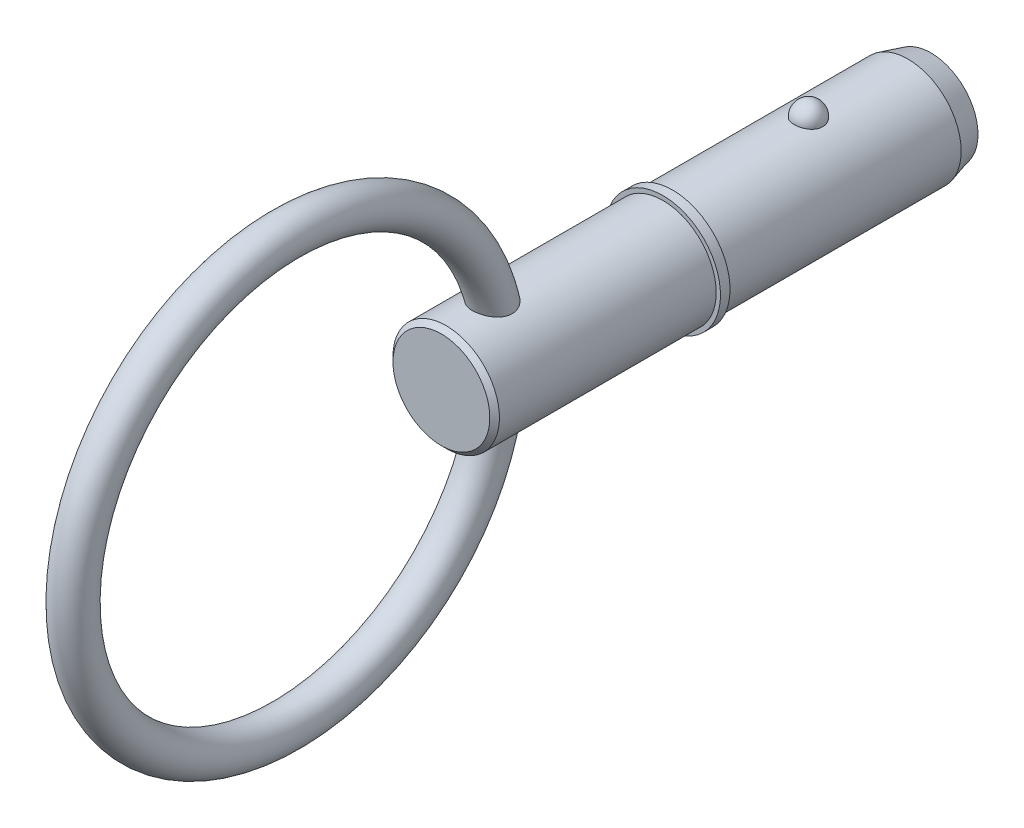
SolidWorks part; units mm, degrees
ref_plane "Front Plane" through (0, 0, 0) normal (0, 0, 1) x (1, 0, 0)
ref_plane "Top Plane" through (0, 0, 0) normal (0, 1, 0) x (1, 0, 0)
ref_plane "Right Plane" through (0, 0, 0) normal (1, 0, 0) x (0, 0, -1)
sketch "Sketch2" plane through (0, 0, 0) normal (0, 0, 1) x (1, 0, 0)
  circle A0 centre (0, 0) radius 5.555
  point P3 (0, 5.555)
  dimension "D1" = 11.11
extrude "Boss-Extrude1" add sketch "Sketch2" along normal blind 12.7
sketch "Sketch3" plane through (0, 0, 0) normal (0, 0, -1) x (-1, 0, 0)
  circle A0 centre (0, 0) radius 5.555
  dimension "D1" = 11.11
extrude "Boss-Extrude2" add sketch "Sketch3" along normal blind 14.27
chamfer "Chamfer1" distance 2.4 angle 15 1 edges at (-5.555, 0, -14.27)
sketch "Sketch18" plane through (0, 0, 0) normal (1, 0, 0) x (0, 0, -1)
  line L0 (11.87, 5.555) -> (-12.7, 5.555) construction
  line L1 (1.49, 7.045) -> (1.49, 4.065)
  line L2 (-12.7, -5.555) -> (11.87, -5.555) construction
  arc A0 (1.49, 7.045) -> (1.49, 4.065) centre (1.49, 5.555) ccw
  point P4 (0, 5.555)
  dimension "D1" = 12.6
revolve "Revolve1" add sketch "Sketch18" angle 360 about L1
sketch "Sketch19" plane through (0, 0, 0) normal (1, 0, 0) x (0, 0, -1)
  line L0 (-33.7288, 0) -> (-46.4542, 0) construction
sketch "Sketch20" plane through (0, 0, 0) normal (1, 0, 0) x (0, 0, -1)
  line L0 (-12.7, 0) -> (-12.7, 6)
  line L1 (-12.7, 5.555) -> (-12.7, -5.555) construction
  line L2 (-12.7, 6) -> (-13.7, 6)
  line L3 (-13.7, 6) -> (-13.7, 0)
  line L4 (-33.7288, 0) -> (-46.4542, 0) construction
  line L5 (-13.7, 0) -> (-12.7, 0)
  dimension "D1" = 6
  dimension "D2" = 1
revolve "Revolve2" add sketch "Sketch20" angle 360 about L0
sketch "Sketch21" plane through (0, 0, 12.7) normal (0, 0, -1) x (-1, 0, 0)
  circle A0 centre (0, 0) radius 5.555
  dimension "D1" = 11.11
extrude "Boss-Extrude3" add sketch "Sketch21" against normal blind 24.13
chamfer "Chamfer2" distance 0.5 angle 45 1 edges at (-5.555, 0, 36.83)
sketch "Sketch23" plane through (0, 0, 0) normal (1, 0, 0) x (0, 0, -1)
  line L0 (-36.83, 5.055) -> (-36.83, -5.055) construction
  circle A0 centre (-53.055, 0) radius 22.225
  point P2 (-30.83, 0)
  dimension "D1" = 44.45
  dimension "D2" = 6
sketch "Sketch24" plane through (0, 0, 0) normal (0, 1, 0) x (1, 0, 0)
  circle A0 centre (0, -30.83) radius 2
  dimension "D1" = 4
sweep "Sweep1" add profiles "Sketch24" path "Sketch23"
